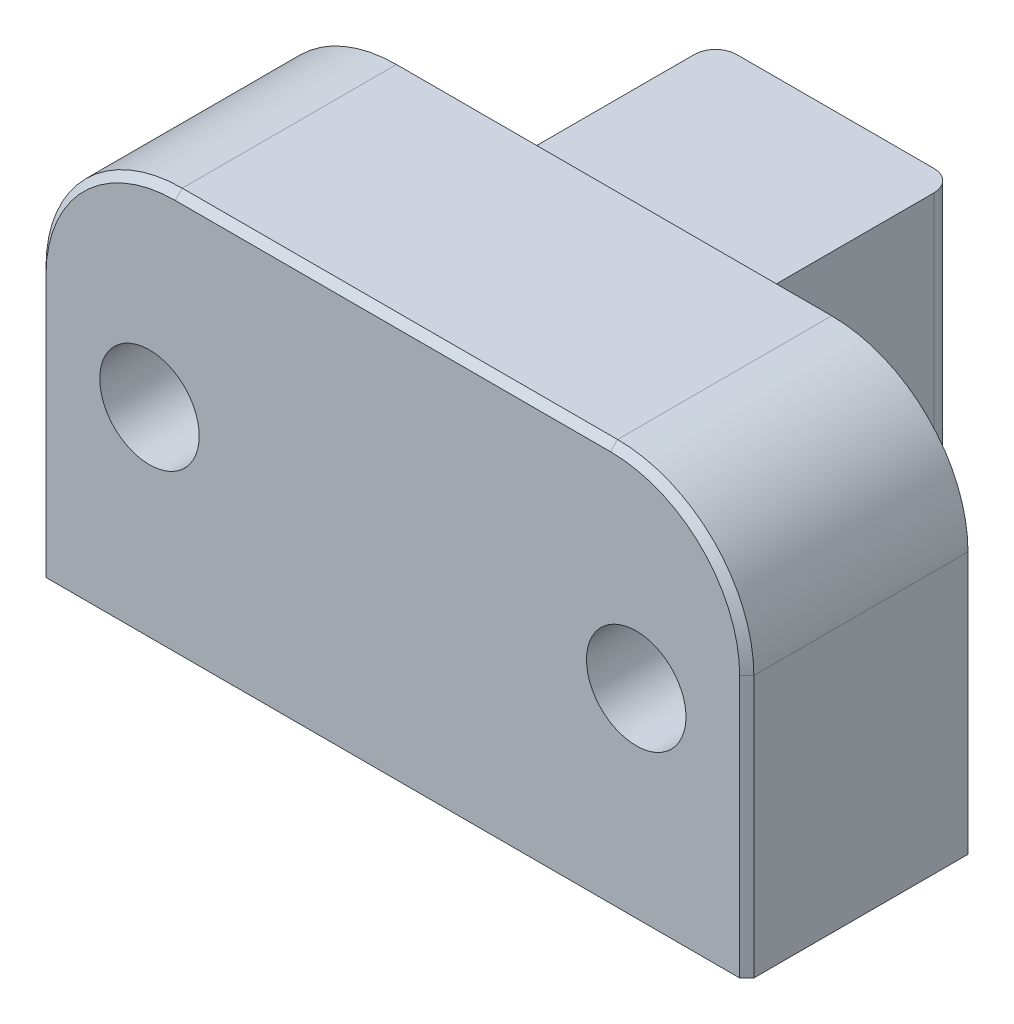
SolidWorks part; units mm, degrees
ref_plane "Front Plane" through (0, 0, 0) normal (0, 0, 1) x (1, 0, 0)
ref_plane "Top Plane" through (0, 0, 0) normal (0, 1, 0) x (1, 0, 0)
ref_plane "Right Plane" through (0, 0, 0) normal (1, 0, 0) x (0, 0, -1)
sketch "Sketch1" plane through (0, 0, 0) normal (0, 1, 0) x (1, 0, 0)
  line L0 (0, 42.6503) -> (0, -22.9644) construction
  line L1 (0, -55) -> (0, 55) construction
  line L2 (-55, 0) -> (55, 0) construction
  line L3 (-25.3936, 0) -> (-8.5979, 0)
  line L4 (-25.3936, 0) -> (-25.3936, -15.875)
  line L5 (-25.3936, -15.875) -> (25.3937, -15.875)
  line L6 (25.3937, 0) -> (25.3937, -15.875)
  line L7 (8.5979, 0) -> (25.3937, 0)
  line L8 (-8.5979, 15.875) -> (-8.5979, 0)
  line L9 (-8.5979, 15.875) -> (8.5979, 15.875)
  line L10 (8.5979, 15.875) -> (8.5979, 0)
  dimension "D1" = 50.7873
  dimension "D2" = 25.3937
  dimension "D3" = 15.875
  dimension "D4" = 17.1958
  dimension "D5" = 8.5979
  dimension "D6" = 15.875
extrude "Extrude1" add sketch "Sketch1" along normal blind 28.575
sketch "Sketch3" plane through (0, 0, 0) normal (1, 0, 0) x (0, 0, -1)
  line L0 (0, 55) -> (0, -55) construction
  line L1 (25.4, -5.329) -> (0, -5.329)
  line L2 (25.4, -5.329) -> (25.4, 3.048)
  line L3 (25.4, 3.048) -> (0, 3.048)
  line L4 (0, -5.329) -> (0, 3.048)
  line L5 (25.4, 25.527) -> (0, 25.527)
  line L6 (25.4, 25.527) -> (25.4, 33.147)
  line L7 (25.4, 33.147) -> (0, 33.147)
  line L8 (0, 25.527) -> (0, 33.147)
  line L9 (0, 28.575) -> (0, 0) construction
  line L10 (0, 28.575) -> (15.875, 28.575) construction
  line L11 (55, 0) -> (-55, 0) construction
  dimension "D1" = 3.048
  dimension "D2" = 3.048
  dimension "D3" = 7.62
  dimension "D4" = 25.4
  dimension "D5" = 25.4
  dimension "D6" = 5.329
extrude "Cut-Extrude2" cut sketch "Sketch3" against normal mid plane 25.4
fillet "Fillet2" radius 1.524 2 edges at (8.5979, 14.2875, -15.875) (-8.5979, 14.2875, -15.875)
fillet "Fillet3" radius 0.7874 2 edges at (-8.5979, 14.2875, 0) (8.5979, 14.2875, 0)
fillet "Fillet4" radius 9.779 2 edges at (25.3937, 28.575, 7.9375) (-25.3936, 28.575, 7.9375)
ref_plane "Plane1" through (0, 14.2875, 0) normal (0, 1, 0) x (-1, 0, 0)
sketch "Sketch4" plane through (0, 14.2875, 0) normal (0, 1, 0) x (-1, 0, 0)
  line L0 (17.4625, 26.8652) -> (17.4625, -2.0432) construction
  line L1 (17.4625, 15.875) -> (13.8938, 15.875)
  line L2 (13.8938, 15.875) -> (13.8938, 6.7564)
  line L3 (13.8938, 6.7564) -> (12.3063, 6.7564)
  line L4 (12.3063, 6.7564) -> (12.3063, 0)
  line L5 (12.3063, 0) -> (17.4625, 0)
  line L6 (17.4625, 0) -> (17.4625, 15.875)
  line L7 (-25.3937, 0) -> (25.3936, 0) construction
  line L8 (25.3936, 15.875) -> (-25.3937, 15.875) construction
  line L10 (0, 15.7163) -> (0, -15.7163) construction
  dimension "D1" = 10.3124
  dimension "D2" = 6.7564
  dimension "D3" = 7.1374
  dimension "D4" = 17.4625
revolve "Cut-Revolve1" cut sketch "Sketch4" angle 360 about L0
mirror "Mirror1" about plane through (0, 0, 0) normal (1, 0, 0) of "Cut-Revolve1"
chamfer "Chamfer1" distance 0.508 angle 45 5 edges at (-25.3936, 9.398, 15.875) (-22.5294, 25.7108, 15.875) (0, 28.575, 15.875) (22.5294, 25.7108, 15.875) (25.3937, 9.398, 15.875)
